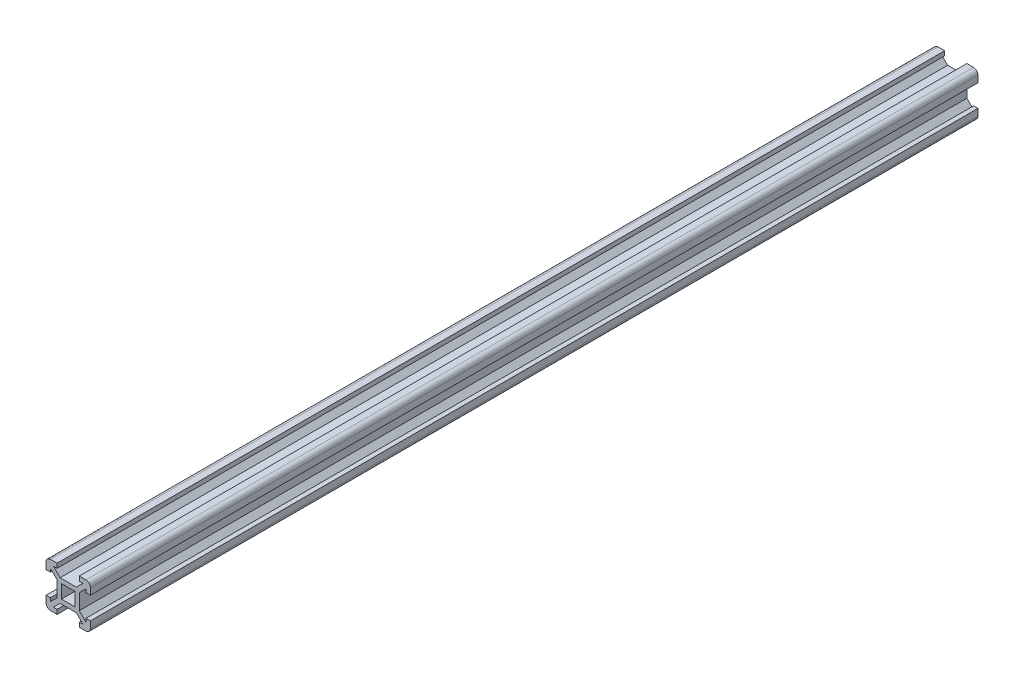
SolidWorks part; units mm, degrees
ref_plane "Plan de face" through (0, 0, 0) normal (0, 0, 1) x (1, 0, 0)
ref_plane "Plan de dessus" through (0, 0, 0) normal (0, 1, 0) x (1, 0, 0)
ref_plane "Plan de droite" through (0, 0, 0) normal (1, 0, 0) x (0, 0, -1)
sketch "Esquisse1" plane through (0, 0, 0) normal (0, 0, 1) x (1, 0, 0)
  line L0 (20, 10) -> (0, 10) construction
  line L1 (5, 13.5227) -> (5, 6.4773)
  line L2 (15, 15) -> (10, 10) construction
  line L3 (2, 20) -> (5, 20)
  line L4 (6.3502, 15) -> (3.3055, 18)
  line L5 (10, 20) -> (10, 0) construction
  line L6 (20, 15) -> (20, 18)
  line L7 (20, 15) -> (18, 15)
  line L8 (15, 20) -> (15, 18)
  line L9 (6.3502, 15) -> (13.6498, 15)
  line L10 (5, 5) -> (10, 10) construction
  line L11 (18, 16.4786) -> (18, 15)
  line L12 (5, 15) -> (10, 10) construction
  line L13 (3.3055, 18) -> (5, 18)
  line L14 (2, 16.4786) -> (2, 15)
  line L15 (16.6945, 18) -> (15, 18)
  line L16 (15, 5) -> (10, 10) construction
  line L17 (13.6498, 15) -> (16.6945, 18)
  line L18 (18, 20) -> (15, 20)
  line L19 (15, 13.5227) -> (15, 6.4773)
  line L21 (5, 13.5227) -> (2, 16.4786)
  line L22 (0, 5) -> (0, 2)
  line L23 (0, 5) -> (2, 5)
  line L24 (5, 0) -> (5, 2)
  line L25 (5, 6.4773) -> (2, 3.5214)
  line L26 (15, 6.4773) -> (18, 3.5214)
  line L27 (18, 0) -> (15, 0)
  line L28 (13.6498, 5) -> (16.6945, 2)
  line L29 (16.6945, 2) -> (15, 2)
  line L30 (5, 20) -> (5, 18)
  line L31 (2, 3.5214) -> (2, 5)
  line L32 (0, 15) -> (2, 15)
  line L33 (3.3055, 2) -> (5, 2)
  line L34 (18, 3.5214) -> (18, 5)
  line L35 (6.3502, 5) -> (13.6498, 5)
  line L36 (15, 0) -> (15, 2)
  line L37 (20, 5) -> (18, 5)
  line L38 (20, 5) -> (20, 2)
  line L39 (6.3502, 5) -> (3.3055, 2)
  line L40 (0, 15) -> (0, 18)
  line L41 (2, 0) -> (5, 0)
  line L42 (15, 13.5227) -> (18, 16.4786)
  line L43 (6.9573, 13.0427) -> (13.0427, 13.0427)
  line L44 (6.9573, 13.0427) -> (6.9573, 6.9573)
  line L45 (6.9573, 6.9573) -> (13.0427, 6.9573)
  line L46 (13.0427, 13.0427) -> (13.0427, 6.9573)
  line L47 (6.9573, 13.0427) -> (13.0427, 6.9573) construction
  line L48 (6.9573, 6.9573) -> (13.0427, 13.0427) construction
  arc A0 (0, 18) -> (2, 20) centre (2, 18) cw
  arc A1 (20, 18) -> (18, 20) centre (18, 18) ccw
  arc A2 (18, 0) -> (20, 2) centre (18, 2) ccw
  arc A3 (0, 2) -> (2, 0) centre (2, 2) ccw
  point P1 (10, 5)
  point P9 (10, 10)
  point P14 (10, 10)
  point P20 (10, 10)
  point P21 (10, 10)
  point P23 (10, 15)
  point P30 (0, 20)
  point P44 (15, 10)
  point P56 (5, 10)
  point P63 (20, 20)
  point P66 (20, 0)
  point P69 (0, 0)
extrude "Extrusion1" add sketch "Esquisse1" along normal blind 400
